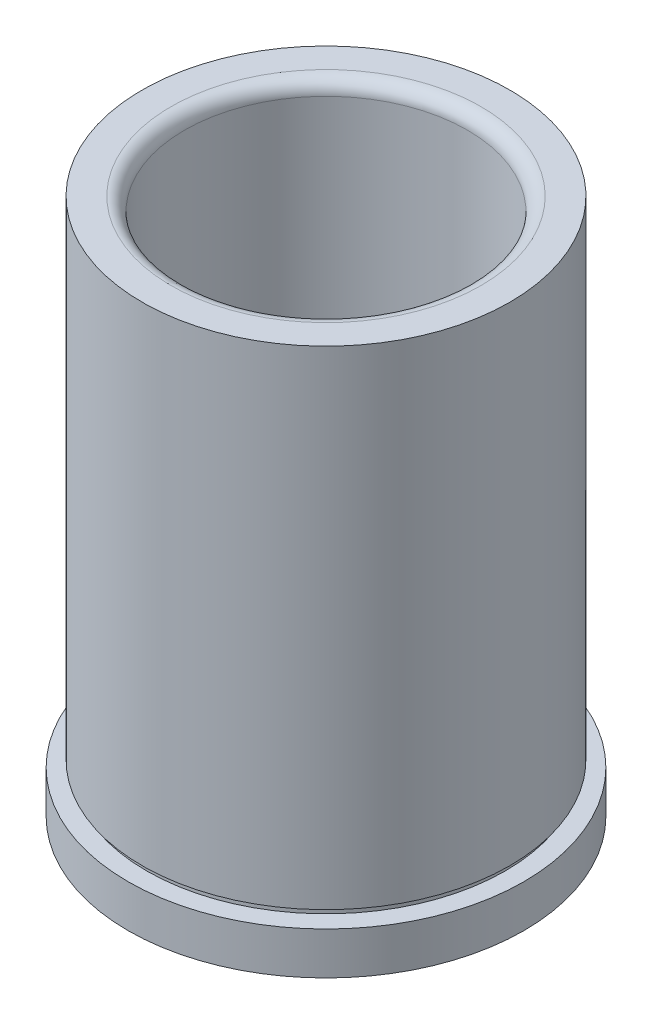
SolidWorks part; units mm, degrees
ref_plane "Front Plane" through (0, 0, 0) normal (0, 0, 1) x (1, 0, 0)
ref_plane "Top Plane" through (0, 0, 0) normal (0, 1, 0) x (1, 0, 0)
ref_plane "Right Plane" through (0, 0, 0) normal (1, 0, 0) x (0, 0, -1)
sketch "Sketch1" plane through (0, 0, 0) normal (0, 0, 1) x (1, 0, 0)
  line L0 (-813.1437, 582.6716) -> (39829.6398, -28540.5863) construction
  line L1 (0, -1000) -> (0, 49000) construction
  line L2 (-15.8814, 76.2507) -> (-15.8813, 16.7417)
  line L3 (-16.6974, 15.9257) -> (-22.225, 15.9257)
  line L4 (-22.225, 15.9257) -> (-22.225, 20.6882)
  line L5 (-22.225, 20.6882) -> (-20.1358, 20.6882)
  line L6 (-20.6438, 76.2507) -> (-20.6438, 21.4502)
  line L7 (-20.6438, 76.2507) -> (-15.8814, 76.2507)
  line L8 (-16.6974, 15.9257) -> (-15.8813, 16.7417)
  line L10 (-20.6438, 21.4502) -> (-20.1358, 21.4502)
  line L11 (-20.1358, 21.4502) -> (-20.1358, 20.6882)
  dimension "D1" = 0.508
  dimension "OD" = 41.2877
  dimension "ID" = 31.7627
  dimension "FLANGETHICKNESS" = 4.7625
  dimension "FLANGEDIA" = 44.45
  dimension "D2" = 45
  dimension "D3" = 0.762
  dimension "OVERALL LENGTH" = 60.325
revolve "Revolve1" add sketch "Sketch1" angle 360 about L1
fillet "Fillet1" radius 1.524 1 edges at (15.8813, 76.2507, 0)
